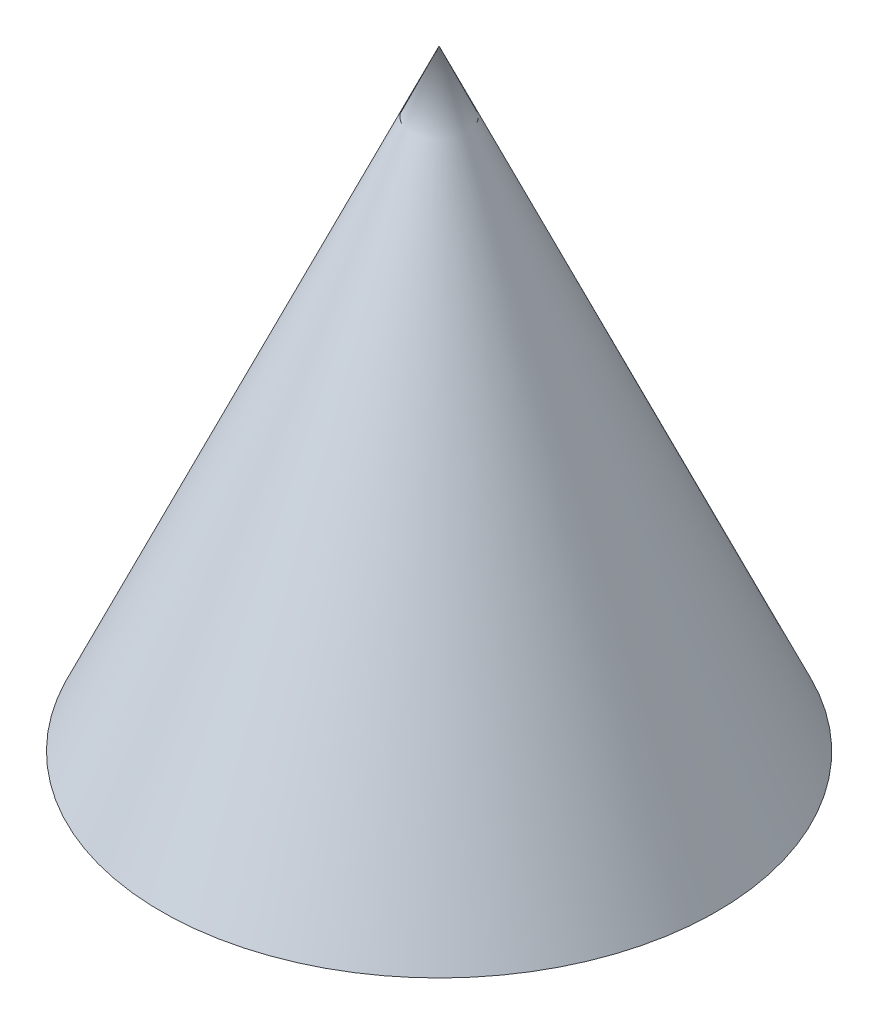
SolidWorks part; units mm, degrees
ref_plane "前视基准面" through (0, 0, 0) normal (0, 0, 1) x (1, 0, 0)
ref_plane "上视基准面" through (0, 0, 0) normal (0, 1, 0) x (1, 0, 0)
ref_plane "右视基准面" through (0, 0, 0) normal (1, 0, 0) x (0, 0, -1)
sketch "草图1" plane through (0, 0, 0) normal (0, 0, 1) x (1, 0, 0)
  line L0 (0, 110) -> (50, 0)
  line L1 (50, 0) -> (0, 0)
  line L2 (0, 0) -> (0, 110) construction
  line L3 (0, 110) -> (0, 0)
  dimension "R" = 50
  dimension "H" = 110
revolve "旋转1" add sketch "草图1" angle 360 about L2
shell "抽壳1" thickness 1
